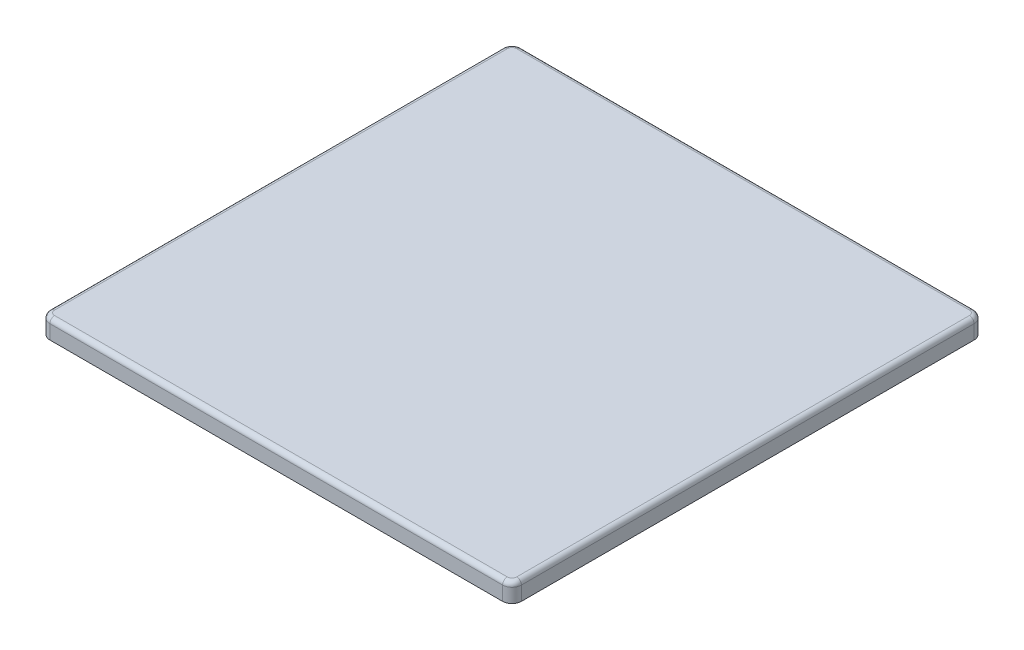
SolidWorks part; units mm, degrees
ref_plane "正面" through (0, 0, 0) normal (0, 0, 1) x (1, 0, 0)
ref_plane "平面" through (0, 0, 0) normal (0, 1, 0) x (1, 0, 0)
ref_plane "右側面" through (0, 0, 0) normal (1, 0, 0) x (0, 0, -1)
sketch "ｽｹｯﾁ1" plane through (0, 0, 0) normal (0, 1, 0) x (0, 0, -1)
  line L1 (-48, 50) -> (48, 50)
  line L2 (-50, 48) -> (-50, -48)
  line L3 (-48, -50) -> (48, -50)
  line L4 (50, 48) -> (50, -48)
  arc A0 (50, 48) -> (48, 50) centre (48, 48) ccw
  arc A1 (48, -50) -> (50, -48) centre (48, -48) ccw
  arc A2 (-50, -48) -> (-48, -50) centre (-48, -48) ccw
  arc A3 (-48, 50) -> (-50, 48) centre (-48, 48) ccw
  point P7 (50, 50)
  point P10 (50, -50)
  point P15 (-50, 50)
  dimension "D5" = 2
  dimension "D1" = 50
  dimension "D2" = 100
  dimension "D3" = 50
  dimension "D4" = 100
extrude "押し出し1" add sketch "ｽｹｯﾁ1" along normal mid plane 4
fillet "ﾌｨﾚｯﾄ1" radius 1 8 edges at (-49.4142, 2, 49.4142) (-50, 2, 0) (-49.4142, 2, -49.4142) (0, 2, -50) (49.4142, 2, -49.4142) (50, 2, 0) (49.4142, 2, 49.4142) (0, 2, 50)
sketch "ｽｹｯﾁ2" plane through (0, -2, 0) normal (0, -1, 0) x (1, 0, 0)
  line L1 (-47.2, 48) -> (47.2, 48)
  line L2 (-48, 47.2) -> (-48, -47.2)
  line L3 (-47.2, -48) -> (47.2, -48)
  line L4 (48, 47.2) -> (48, -47.2)
  arc A0 (-47.2, 48) -> (-48, 47.2) centre (-47.2, 47.2) ccw
  arc A1 (48, 47.2) -> (47.2, 48) centre (47.2, 47.2) ccw
  arc A2 (47.2, -48) -> (48, -47.2) centre (47.2, -47.2) ccw
  arc A3 (-48, -47.2) -> (-47.2, -48) centre (-47.2, -47.2) ccw
  point P7 (-48, 48)
  point P10 (48, 48)
  point P13 (48, -48)
  dimension "D5" = 0.8
  dimension "D1" = 48
  dimension "D2" = 96
  dimension "D3" = 48
  dimension "D4" = 96
extrude "押し出し2" cut sketch "ｽｹｯﾁ2" against normal blind 2
sketch "ｽｹｯﾁ4" plane through (0, 0, 0) normal (0, -1, 0) x (1, 0, 0)
  line L0 (25.7071, -28.7477) -> (28.7477, -25.7071)
  line L1 (-28.7477, 25.7071) -> (-25.7071, 28.7477)
  line L2 (-28.7477, 25.7071) -> (-24.2929, 21.2523)
  line L3 (-24.2929, 21.2523) -> (-21.2523, 24.2929)
  line L4 (-25.7071, 28.7477) -> (-21.2523, 24.2929)
  line L5 (27.2274, -27.2274) -> (22.7726, -22.7726) construction
  line L6 (21.2523, 25.7071) -> (24.2929, 28.7477)
  line L7 (21.2523, 25.7071) -> (25.7071, 21.2523)
  line L8 (25.7071, 21.2523) -> (28.7477, 24.2929)
  line L9 (24.2929, 28.7477) -> (28.7477, 24.2929)
  line L10 (-27.2274, 27.2274) -> (-22.7726, 22.7726) construction
  line L11 (-25.7071, -21.2523) -> (-21.2523, -25.7071)
  line L12 (-26.5203, 23.4797) -> (-23.4797, 26.5203) construction
  line L13 (27.2274, 22.7726) -> (22.7726, 27.2274) construction
  line L14 (-28.7477, -24.2929) -> (-25.7071, -21.2523)
  line L15 (26.5203, 26.5203) -> (23.4797, 23.4797) construction
  line L16 (24.2929, -21.2523) -> (28.7477, -25.7071)
  line L17 (26.5203, -23.4797) -> (23.4797, -26.5203) construction
  line L18 (21.2523, -24.2929) -> (24.2929, -21.2523)
  line L19 (-28.7477, -24.2929) -> (-24.2929, -28.7477)
  line L20 (-27.2274, -22.7726) -> (-22.7726, -27.2274) construction
  line L21 (21.2523, -24.2929) -> (25.7071, -28.7477)
  line L22 (-24.2929, -28.7477) -> (-21.2523, -25.7071)
  line L23 (-26.5203, -26.5203) -> (-23.4797, -23.4797) construction
  dimension "D1" = 4.3
  dimension "D2" = 6.3
  dimension "D3" = 4.3
  dimension "D4" = 6.3
  dimension "D5" = 4.3
  dimension "D6" = 4.3
extrude "押し出し4" add sketch "ｽｹｯﾁ4" along normal blind 11 draft 0.5
fillet "ﾌｨﾚｯﾄ2" radius 0.8 16 edges at (-27.1595, -11, 27.1595) (-23.5476, -11, 26.4524) (-22.8405, -11, 22.8405) (-26.4524, -11, 23.5476) (22.8405, -11, 27.1595) (26.4524, -11, 26.4524) (27.1595, -11, 22.8405) (23.5476, -11, 23.5476) (22.8405, -11, -22.8405) (26.4524, -11, -23.5476) (27.1595, -11, -27.1595) (23.5476, -11, -26.4524) (-27.1595, -11, -22.8405) (-23.5476, -11, -23.5476) (-22.8405, -11, -27.1595) (-26.4524, -11, -26.4524)
